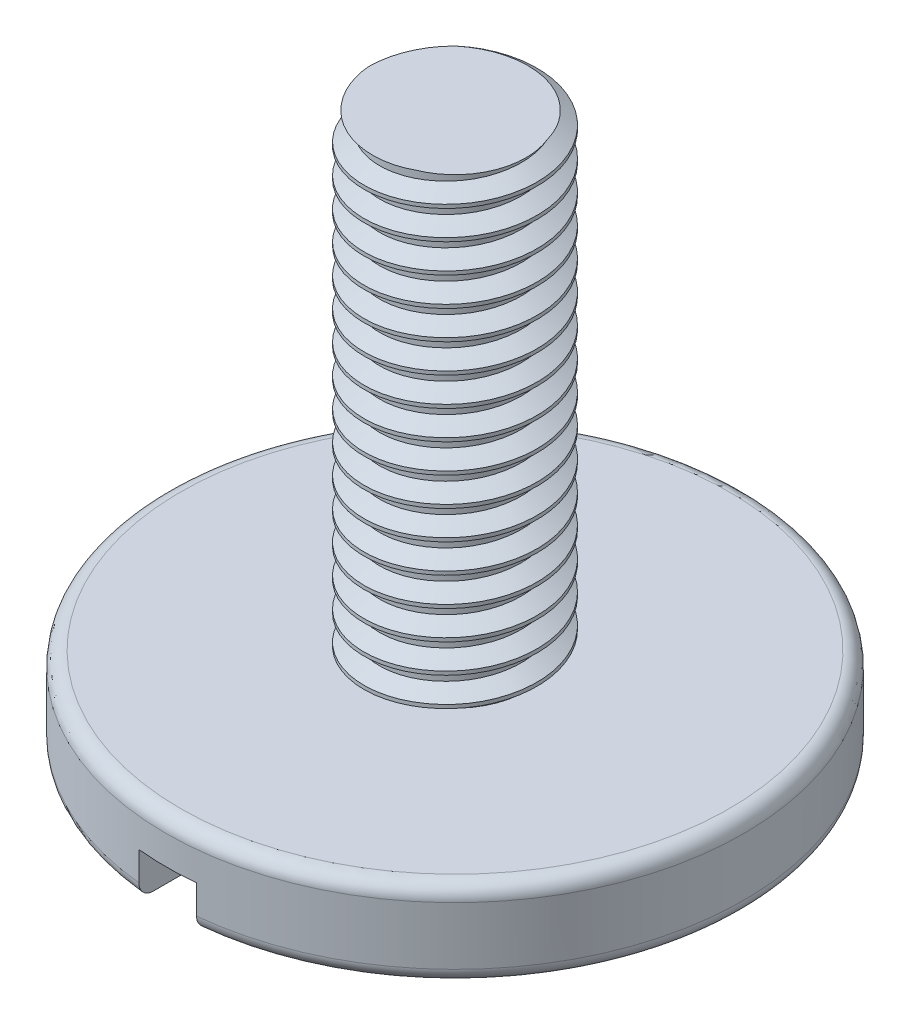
SolidWorks part; units mm, degrees
ref_plane "Front Plane" through (0, 0, 0) normal (0, 0, 1) x (1, 0, 0)
ref_plane "Top Plane" through (0, 0, 0) normal (0, 1, 0) x (1, 0, 0)
ref_plane "Right Plane" through (0, 0, 0) normal (1, 0, 0) x (0, 0, -1)
sketch "Sketch1" plane through (0, 0, 0) normal (0, 1, 0) x (1, 0, 0)
  circle A0 centre (0, 0) radius 10
extrude "Boss-Extrude1" add sketch "Sketch1" along normal blind 3
sketch "Sketch2" plane through (0, 3, 0) normal (0, 1, 0) x (1, 0, 0)
  circle A0 centre (0, 0) radius 3
extrude "Boss-Extrude2" add sketch "Sketch2" along normal blind 16
thread "Thread1" pitch 1 start angle 0, offset 1, length 17, pitch 1, diameter 6
ref_plane "Plane1" through (-3, 20, 0) normal (0, 0, 1) x (-1, 0, 0)
sketch "Thread Profile1" plane through (-3, 20, 0) normal (0, 0, 1) x (-1, 0, 0)
  line L0 (0, 0) -> (0, 1) construction
  line L11 (0, 0) -> (0, 0.875)
  line L12 (0, 0.875) -> (-0.5413, 0.5625)
  line L13 (-0.5413, 0.5625) -> (-0.5413, 0.3125)
  line L15 (-0.5413, 0.3125) -> (0, 0)
  line L17 (-0.5413, 0.4375) -> (0, 0.4375) construction
  point P2 (0, 0)
  dimension "Pitch" = 1
  dimension "Profile_Angle" = 60
  dimension "Profile_Land" = 0.25
  dimension "Profile_Height" = 0.5413
sketch "Sketch7" plane through (0, 0, 0) normal (0, -1, 0) x (1, 0, 0)
  line L0 (0, -12.5371) -> (0, 12.5371) construction
  line L2 (-1, -10.5) -> (1, -10.5)
  line L3 (-1, -10.5) -> (-1, 10.5)
  line L4 (-1, 10.5) -> (1, 10.5)
  line L5 (1, -10.5) -> (1, 10.5)
  point P5 (0, 0)
  point P10 (0, -10.5)
  point P11 (1, 0)
  dimension "D1" = 2
  dimension "D2" = 21
extrude "Cut-Extrude1" cut sketch "Sketch7" against normal blind 1.5
fillet "Fillet1" radius 0.5 3 edges at (0, 3, 10) (-10, 0, 0) (10, 0, 0)
